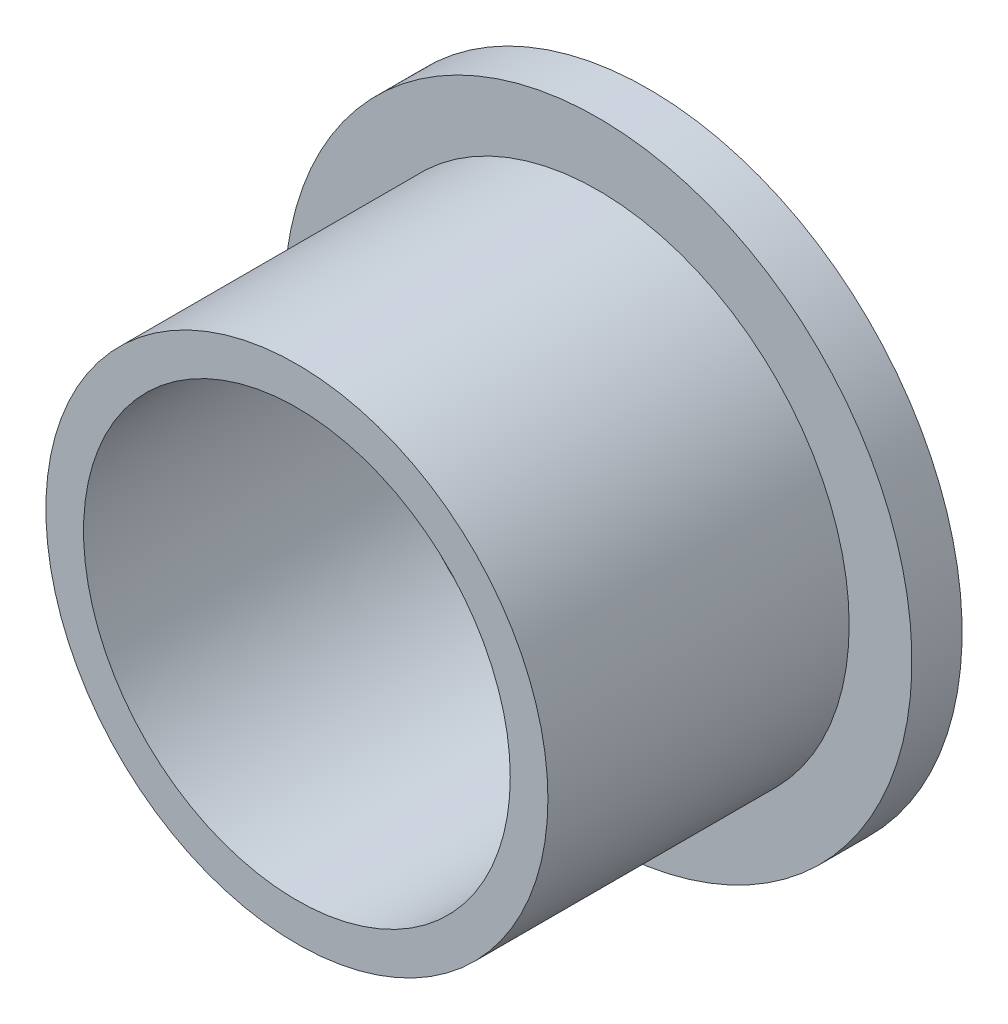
SolidWorks part; units mm, degrees
ref_plane "Front Plane" through (0, 0, 0) normal (0, 0, 1) x (1, 0, 0)
ref_plane "Top Plane" through (0, 0, 0) normal (0, 1, 0) x (1, 0, 0)
ref_plane "Right Plane" through (0, 0, 0) normal (1, 0, 0) x (0, 0, -1)
sketch "Sketch1" plane through (0, 0, 0) normal (0, 0, 1) x (1, 0, 0)
  circle A0 centre (0, 0) radius 8.5
  circle A1 centre (0, 0) radius 10
  dimension "D1" = 17
  dimension "D2" = 20
extrude "Boss-Extrude1" add sketch "Sketch1" along normal blind 12
sketch "Sketch2" plane through (0, 0, 0) normal (0, 0, -1) x (-1, 0, 0)
  circle A0 centre (0, 0) radius 12.5
  dimension "D1" = 25
extrude "Boss-Extrude2" add sketch "Sketch2" along normal blind 2
